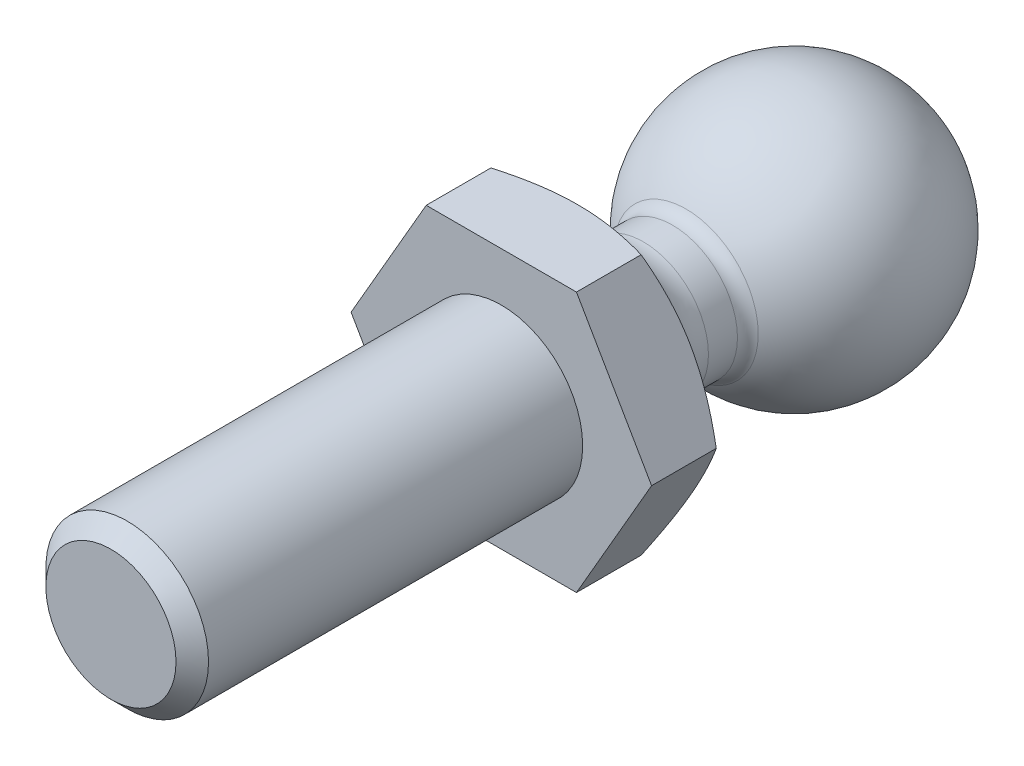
SolidWorks part; units mm, degrees
ref_plane "Face" through (0, 0, 0) normal (0, 0, 1) x (1, 0, 0)
ref_plane "Dessus" through (0, 0, 0) normal (0, 1, 0) x (1, 0, 0)
ref_plane "Droite" through (0, 0, 0) normal (1, 0, 0) x (0, 0, -1)
sketch "Esquisse1" plane through (0, 0, 0) normal (0, 0, 1) x (1, 0, 0)
  line L1 (4.6188, 0) -> (2.3094, 4)
  line L2 (2.3094, 4) -> (-2.3094, 4)
  line L3 (-2.3094, 4) -> (-4.6188, 0)
  line L4 (-4.6188, 0) -> (-2.3094, -4)
  line L5 (-2.3094, -4) -> (2.3094, -4)
  line L6 (2.3094, -4) -> (4.6188, 0)
  circle A0 centre (0, 0) radius 4 construction
  dimension "D1" = 8
extrude "Extrusion1" add sketch "Esquisse1" against normal blind 12.5
sketch "Esquisse3" plane through (0, 0, 0) normal (1, 0, 0) x (0, 0, -1)
  line L0 (1.8976, 4.7754) -> (3.067, 2.75)
  line L1 (4.366, 2) -> (5.2583, 2)
  line L2 (1.8976, 4.7754) -> (-0.46, 4.7754)
  line L3 (12.5, 0) -> (0, 0) construction
  line L4 (-0.46, 0) -> (13.1944, 0) construction
  line L5 (0, 0) -> (0, 4) construction
  line L6 (-0.46, 4.7754) -> (-0.46, 5.865)
  line L7 (-0.46, 5.865) -> (13.8449, 5.865)
  line L8 (13.8449, 5.865) -> (13.8449, 0)
  line L9 (13.8449, 0) -> (13, 0)
  arc A0 (13, 0) -> (5.6741, 2.2222) centre (9, 0) ccw
  arc A1 (5.6741, 2.2222) -> (5.2583, 2) centre (5.2583, 2.5) cw
  arc A2 (3.067, 2.75) -> (4.366, 2) centre (4.366, 3.5) ccw
  point P20 (3.5, 2)
  dimension "D1" = 8
  dimension "D6" = 0.5
  dimension "D7" = 1.5
  dimension "D2" = 4
  dimension "D3" = 30
  dimension "D4" = 9
  dimension "D5" = 3.5
revolve "Enlèvement de matière-Révolution1" cut sketch "Esquisse3" angle 360 about L4
sketch "Esquisse4" plane through (0, 0, 0) normal (0, 0, 1) x (1, 0, 0)
  circle A0 centre (0, 0) radius 2.5
  dimension "D1" = 5
extrude "Extrusion2" add sketch "Esquisse4" along normal blind 12
chamfer "Chanfrein1" distance 0.5 angle 45
